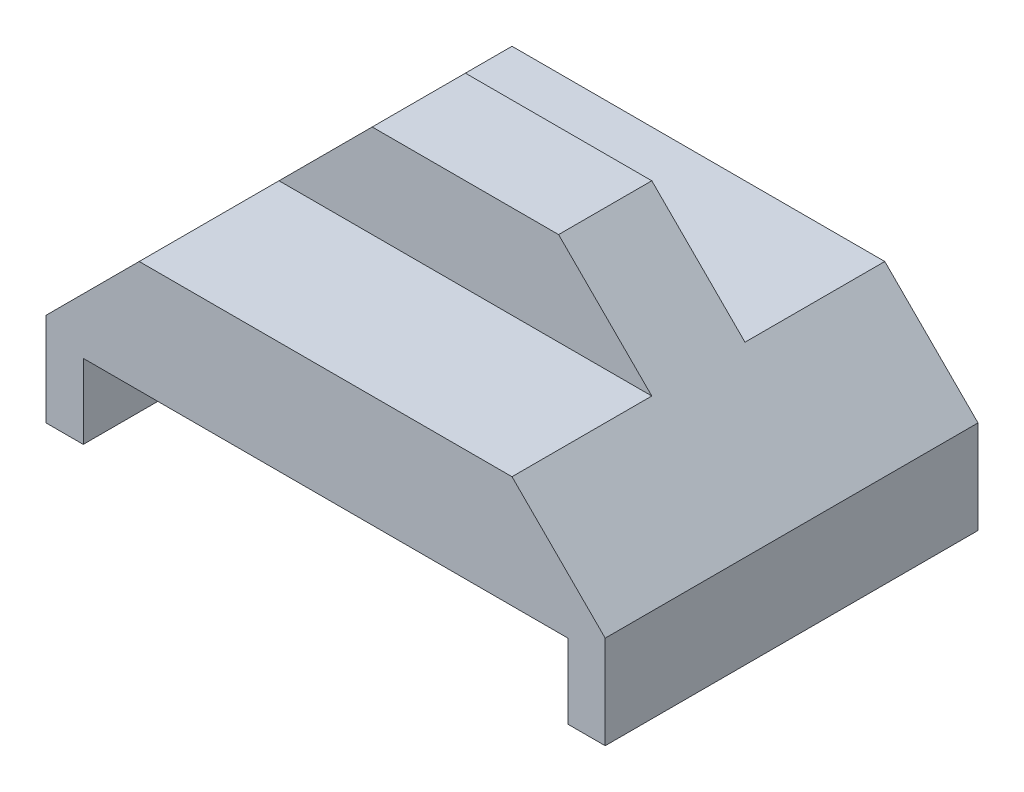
SolidWorks part; units mm, degrees
ref_plane "前视基准面" through (0, 0, 0) normal (0, 0, 1) x (1, 0, 0)
ref_plane "上视基准面" through (0, 0, 0) normal (0, 1, 0) x (1, 0, 0)
ref_plane "右视基准面" through (0, 0, 0) normal (1, 0, 0) x (0, 0, -1)
sketch "草图1" plane through (0, 0, 0) normal (0, 1, 0) x (1, 0, 0)
  line L1 (0, 0) -> (30, 0)
  line L2 (0, 0) -> (0, 20)
  line L3 (0, 20) -> (30, 20)
  line L4 (30, 0) -> (30, 20)
  dimension "D1" = 20
  dimension "D2" = 30
extrude "拉伸1" add sketch "草图1" along normal blind 10
sketch "草图2" plane through (0, 0, 0) normal (0, 0, 1) x (1, 0, 0)
  line L0 (0, 0) -> (30, 0) construction
  line L1 (2, 0) -> (28, 0)
  line L2 (2, 0) -> (2, 4)
  line L3 (2, 4) -> (28, 4)
  line L4 (28, 0) -> (28, 4)
  line L5 (15, 10) -> (15, 12.567) construction
  line L6 (0, 10) -> (30, 10) construction
  line L7 (0, 10) -> (0, 0) construction
  line L8 (0, 5) -> (5, 10)
  line L9 (5, 10) -> (0, 10)
  line L10 (0, 10) -> (0, 5)
  line L11 (30, 10) -> (30, 5)
  line L12 (25, 10) -> (30, 10)
  line L13 (30, 5) -> (25, 10)
  dimension "D1" = 2
  dimension "D2" = 6
  dimension "D3" = 45
extrude "切除-拉伸1" cut sketch "草图2" against normal through all
ref_plane "基准面1" through (0, 0, -10) normal (0, 0, 1) x (1, 0, 0)
sketch "草图3" plane through (0, 0, -10) normal (0, 0, 1) x (1, 0, 0)
  line L0 (5, 10) -> (10, 15)
  line L1 (10, 15) -> (20, 15)
  line L2 (20, 15) -> (25, 10)
  line L3 (25, 10) -> (5, 10)
  line L4 (25, 10) -> (30, 5) construction
  line L5 (0, 5) -> (5, 10) construction
  dimension "D1" = 5
extrude "拉伸2" add sketch "草图3" along normal mid plane 5
